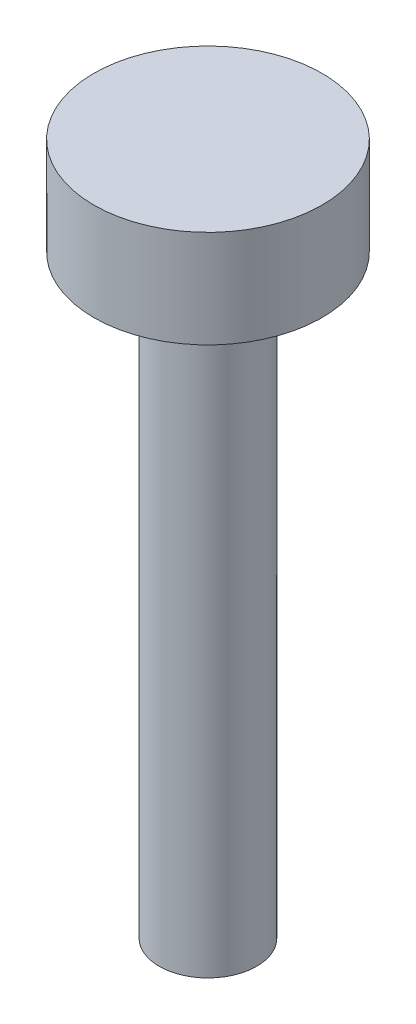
SolidWorks part; units mm, degrees
ref_plane "Front Plane" through (0, 0, 0) normal (0, 0, 1) x (1, 0, 0)
ref_plane "Top Plane" through (0, 0, 0) normal (0, 1, 0) x (1, 0, 0)
ref_plane "Right Plane" through (0, 0, 0) normal (1, 0, 0) x (0, 0, -1)
sketch "Sketch2" plane through (0, 0, 0) normal (1, 0, 0) x (0, 0, -1)
  line L0 (0, -25.4) -> (0, 4.1656)
  line L1 (0, 4.1656) -> (4.8768, 4.1656)
  line L2 (4.8768, 4.1656) -> (4.8768, 0)
  line L3 (4.8768, 0) -> (2.0828, 0)
  line L4 (2.0828, 0) -> (2.0828, -25.4)
  line L5 (2.0828, -25.4) -> (0, -25.4)
  line L6 (0, 3.2765) -> (0, -26.9706) construction
  dimension "General Head height" = 4.1656
  dimension "Body length" = 25.4
  dimension "General Head Diameter" = 9.7536
  dimension "Body Diameter" = 4.1656
revolve "Body" add sketch "Sketch2" angle 360 about L0
sketch "Sketch13" plane through (0, 0, 0) normal (1, 0, 0) x (0, 0, -1)
  line L0 (0, 3.6912) -> (0, 2.4384) construction
  line L1 (0, -25.4) -> (0, 4.1656) construction
  line L2 (0, 4.1656) -> (4.8768, 4.1656) construction
  line L3 (4.8768, 4.1656) -> (4.8768, 0) construction
  line L4 (4.0894, 1.1176) -> (4.0894, 0)
  line L5 (4.0894, 0) -> (4.8768, 0)
  line L6 (4.8768, 0) -> (4.8768, 4.1656)
  line L7 (4.8768, 4.1656) -> (0, 4.1656)
  line L8 (0, 4.1656) -> (0, 2.4384)
  line L9 (0, 0) -> (0, -1.2127) construction
  line L12 (0, 2.4384) -> (2.7686, 2.4384)
  arc A2 (2.7686, 2.4384) -> (4.0894, 1.1176) centre (2.7686, 1.1176) cw
  dimension "D1" = 1.3208
  dimension "Panhead(phillips) Diameter" = 8.1788
  dimension "Panhead(phillips) Height" = 2.4384
revolve "Pan Head (Phillips)" cut sketch "Sketch13" angle 360 about L0
sketch "Sketch15" plane through (0, 0, 0) normal (1, 0, 0) x (0, 0, -1)
  line L0 (-2.7686, 2.4384) -> (0, 0.127) construction
  line L1 (0, 0.127) -> (2.7686, 2.4384) construction
  line L2 (-0.9127, 0.889) -> (0.9127, 0.889)
  line L3 (-2.7686, 2.4384) -> (-0.9127, 0.889)
  line L4 (2.7686, 2.4384) -> (0.9127, 0.889)
  line L5 (2.7686, 2.4384) -> (-2.7686, 2.4384) construction
  line L6 (2.7686, 2.4384) -> (-2.7686, 2.4384)
  dimension "D1" = 0.762
  dimension "Pan Head Recess Height" = 2.3114
extrude "Pan Head Phillips slot 1" cut sketch "Sketch15" against normal mid plane 1.0414
pattern_circular "Pan Head Phillips slot 2" count 2 every 90 about axis through (0, 0, 0) along (0, 1, 0) of "Pan Head Phillips slot 1"
sketch "Phillips Driver Size=2" plane through (0, 0, 0) normal (0, 0, 1) x (1, 0, 0)
  line L0 (3.175, 40.64) -> (14.986, 40.64)
  line L1 (-14.986, 91.44) -> (-14.986, 40.64)
  line L2 (-3.175, 2.6507) -> (-3.175, 40.64)
  line L3 (-3.175, 2.6507) -> (3.175, 2.6507)
  line L4 (3.175, 2.6507) -> (3.175, 40.64)
  line L5 (-14.986, 40.64) -> (-3.175, 40.64)
  line L6 (14.986, 91.44) -> (14.986, 40.64)
  line L7 (-14.986, 91.44) -> (14.986, 91.44)
  line L10 (0, 0) -> (-3.175, 2.6507)
  line L11 (3.175, 2.6507) -> (0, 0)
  line L12 (2.7676, 2.4375) -> (0.9127, 0.889) construction
  point P8 (0, 78.2375)
  dimension "D1" = 14.986
  dimension "Phillips Driver Size" = 6.35
  dimension "D2" = 29.972
  dimension "D3" = 40.64
  dimension "D4" = 50.8
sketch "Top View Phillips Screw Driver Handle" plane through (0, 0, 0) normal (0, 1, 0) x (1, 0, 0)
  circle A0 centre (0, 0) radius 14.986
  dimension "D1" = 29.972
sketch "Sketch17" plane through (0, 0, 0) normal (0, 1, 0) x (1, 0, 0)
  circle A0 centre (0, 0) radius 4.8768
  dimension "D1" = 9.7536
extrude "#8 MAX HEAD SIZE" add sketch "Sketch17" along normal blind 4.1656 separate body
